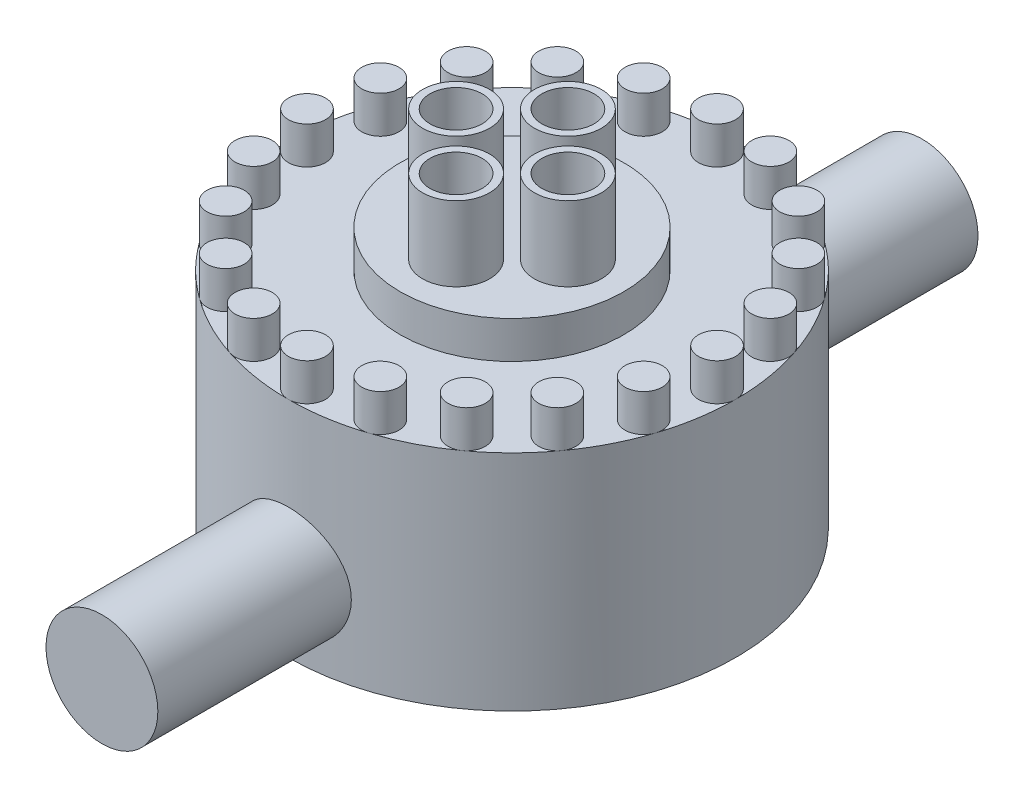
SolidWorks part; units mm, degrees
ref_plane "Front Plane" through (0, 0, 0) normal (0, 0, 1) x (1, 0, 0)
ref_plane "Top Plane" through (0, 0, 0) normal (0, 1, 0) x (1, 0, 0)
ref_plane "Right Plane" through (0, 0, 0) normal (1, 0, 0) x (0, 0, -1)
sketch "Sketch1" plane through (0, 0, 0) normal (0, 1, 0) x (1, 0, 0)
  circle A0 centre (0, 0) radius 300
  dimension "D1" = 600
extrude "Boss-Extrude1" add sketch "Sketch1" along normal blind 300
sketch "Sketch2" plane through (0, 300, 0) normal (0, 1, 0) x (1, 0, 0)
  line L0 (0, 0) -> (0, 275)
  circle A1 centre (0, 275) radius 25
  circle A2 centre (84.9797, 261.5405) radius 25
  circle A3 centre (161.6409, 222.4797) radius 25
  circle A4 centre (222.4797, 161.6409) radius 25
  circle A5 centre (261.5405, 84.9797) radius 25
  circle A6 centre (275, 0) radius 25
  circle A7 centre (261.5405, -84.9797) radius 25
  circle A8 centre (222.4797, -161.6409) radius 25
  circle A9 centre (161.6409, -222.4797) radius 25
  circle A10 centre (84.9797, -261.5405) radius 25
  circle A11 centre (0, -275) radius 25
  circle A12 centre (-84.9797, -261.5405) radius 25
  circle A13 centre (-161.6409, -222.4797) radius 25
  circle A14 centre (-222.4797, -161.6409) radius 25
  circle A15 centre (-261.5405, -84.9797) radius 25
  circle A16 centre (-275, 0) radius 25
  circle A17 centre (-261.5405, 84.9797) radius 25
  circle A18 centre (-222.4797, 161.6409) radius 25
  circle A19 centre (-161.6409, 222.4797) radius 25
  circle A20 centre (-84.9797, 261.5405) radius 25
  dimension "D2" = 20
  dimension "D1" = 275
extrude "Boss-Extrude2" add sketch "Sketch2" along normal blind 50 contours A20 | A19 | A18 | A17 | A16 | A15 | A14 | A13 | A12 | A11 | A10 | A9 | A8 | A7 | A6 | A5 | A4 | A3 | A2 | A1
sketch "Sketch3" plane through (0, 300, 0) normal (0, 1, 0) x (1, 0, 0)
  circle A0 centre (0, 0) radius 125
  circle A1 centre (0, 0) radius 150
extrude "Boss-Extrude3" add sketch "Sketch3" along normal blind 50 contours A1
sketch "Sketch4" plane through (0, 350, 0) normal (0, 1, 0) x (1, 0, 0)
  line L0 (0, 0) -> (0, 75)
  circle A0 centre (0, 0) radius 75
  circle A1 centre (0, 75) radius 35
  circle A2 centre (75, 0) radius 35
  circle A3 centre (0, -75) radius 35
  circle A4 centre (-75, 0) radius 35
  dimension "D1" = 4
  dimension "D2" = 150
  dimension "D3" = 70
extrude "Cut-Extrude2" cut sketch "Sketch4" against normal through all contours A1 | A4 | A3 | A2
sketch "Sketch5" plane through (0, 350, 0) normal (0, 1, 0) x (1, 0, 0)
  circle A0 centre (0, 75) radius 45
  circle A1 centre (0, 75) radius 35
  circle A2 centre (75, 0) radius 45
  circle A3 centre (75, 0) radius 35
  circle A4 centre (0, -75) radius 45
  circle A5 centre (0, -75) radius 35
  circle A6 centre (-75, 0) radius 45
  circle A7 centre (-75, 0) radius 35
  dimension "D1" = 4
extrude "Boss-Extrude5" add sketch "Sketch5" along normal blind 100
ref_plane "Plane1" through (0, 0, 150) normal (0, 0, 1) x (1, 0, 0)
sketch "Sketch7" plane through (0, 0, 150) normal (0, 0, 1) x (1, 0, 0)
  line L0 (0, 0) -> (0, 100)
  circle A0 centre (0, 100) radius 75
  dimension "D1" = 100
extrude "Boss-Extrude6" add sketch "Sketch7" along normal blind 400 contours A0
ref_plane "Plane2" through (0, 0, -150) normal (0, 0, 1) x (1, 0, 0)
sketch "Sketch8" plane through (0, 0, -150) normal (0, 0, 1) x (1, 0, 0)
  line L0 (0, 0) -> (0, 102.5052)
  circle A0 centre (0, 102.5052) radius 75
extrude "Boss-Extrude7" add sketch "Sketch8" against normal blind 400 contours A0
